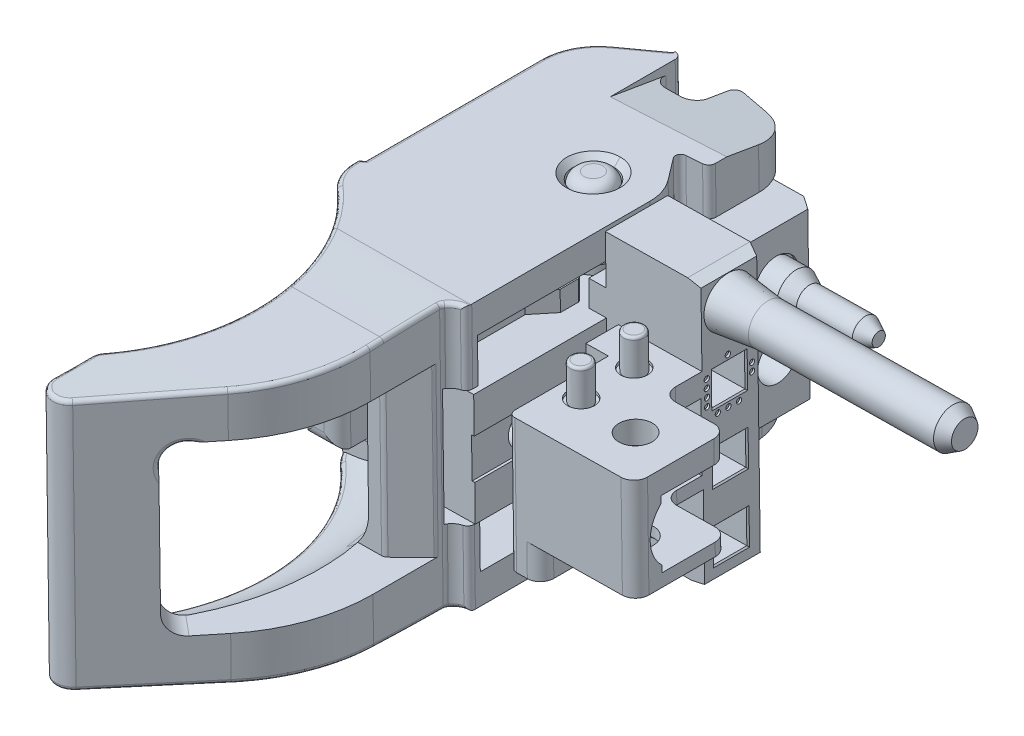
SolidWorks part; units mm, degrees
ref_plane "前视基准面" through (0, 0, 0) normal (0, 0, 1) x (1, 0, 0)
ref_plane "上视基准面" through (0, 0, 0) normal (0, 1, 0) x (1, 0, 0)
ref_plane "右视基准面" through (0, 0, 0) normal (1, 0, 0) x (0, 0, -1)
imported_body "输入1"
imported_body "输入2" [suppressed]
imported_body "输入3" [suppressed]
imported_body "输入4"
imported_body "输入5"
imported_body "输入6"
imported_body "输入7" [suppressed]
imported_body "输入8" [suppressed]
sketch "草图1" plane through (-67.3031, -0.9398, 0) normal (0.9999, 0.014, 0) x (0, 0, -1)
  line L1 (1.8295, -67.0579) -> (3.9878, -67.0579)
  line L2 (1.8295, -67.0579) -> (1.8295, -65.1815)
  line L3 (1.8295, -65.1815) -> (3.9878, -65.1815)
  line L4 (3.9878, -67.0579) -> (3.9878, -65.1815)
  line L5 (1.9055, -62.0686) -> (3.9878, -62.0686)
  line L6 (1.9055, -62.0686) -> (1.9055, -60.0946)
  line L7 (1.9055, -60.0946) -> (3.9878, -60.0946)
  line L8 (3.9878, -62.0686) -> (3.9878, -60.0946)
  line L9 (1.9055, -56.884) -> (3.9878, -56.884)
  line L10 (1.9055, -56.884) -> (1.9055, -55.0401)
  line L11 (1.9055, -55.0401) -> (3.9878, -55.0401)
  line L12 (3.9878, -56.884) -> (3.9878, -55.0401)
extrude "切除-拉伸1" cut sketch "草图1" along normal blind 1
sketch "草图3" plane through (-67.3031, -0.9398, 0) normal (0.9999, 0.014, 0) x (0, 0, -1)
  line L0 (3.7999, -67.3354) -> (3.7999, -64.9212) construction
  line L1 (1.6499, -64.9212) -> (4.1499, -64.9212) construction
  line L2 (2.8999, -64.9212) -> (2.8999, -67.3543) construction
  line L3 (3.7999, -62.2599) -> (3.7999, -59.8412) construction
  line L4 (1.6499, -59.8412) -> (4.1499, -59.8412) construction
  line L5 (3.7999, -57.2048) -> (3.7999, -54.7612) construction
  line L6 (1.6499, -54.7612) -> (4.1499, -54.7612) construction
  text T0 "A" font "黑体" height 1.8
  text T1 "B" font "黑体" height 1.8
  text T2 "C" font "黑体" height 1.8
  dimension "D1" = 0.9
extrude "凸台-拉伸1" add sketch "草图3" along normal blind 0.2
